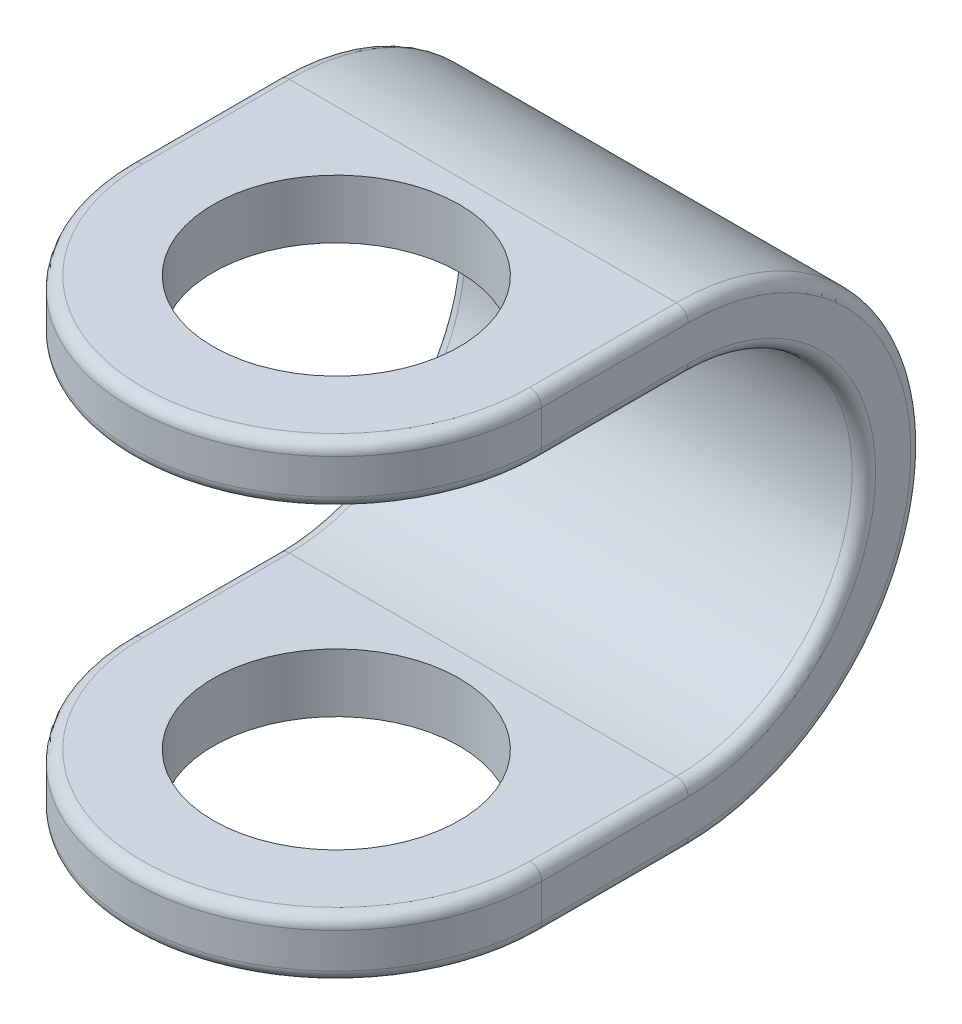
SolidWorks part; units mm, degrees
ref_plane "Front" through (0, 0, 0) normal (0, 0, 1) x (1, 0, 0)
ref_plane "Top" through (0, 0, 0) normal (0, 1, 0) x (1, 0, 0)
ref_plane "Right" through (0, 0, 0) normal (1, 0, 0) x (0, 0, -1)
sketch "Sketch1" plane through (0, 0, 0) normal (0, 1, 0) x (1, 0, 0)
  line L0 (-35, 0) -> (-35, 65)
  line L1 (-35, 65) -> (35, 65)
  line L2 (35, 65) -> (35, 0)
  arc A0 (35, 0) -> (-35, 0) centre (0, 0) cw
  dimension "D1" = 35
  dimension "D2" = 65
extrude "Base-Extrude" add sketch "Sketch1" along normal blind 80
sketch "Sketch2" plane through (35, 0, 0) normal (1, 0, 0) x (0, 0, -1)
  line L5 (0, 80) -> (65, 80) construction
  line L6 (0, 0) -> (65, 0) construction
  line L7 (65, 80) -> (65, 0) construction
  arc A0 (25, 80) -> (25, 0) centre (25, 40) cw
extrude "Cut-Extrude1" cut sketch "Sketch2" against normal through all and the other way through all
shell "Shell1" thickness 10
sketch "Sketch3" plane through (0, 80, 0) normal (0, 1, 0) x (-1, 0, 0)
  circle A0 centre (0, 0) radius 21
  dimension "D1" = 42
extrude "Cut-Extrude2" cut sketch "Sketch3" against normal through all
fillet "Fillet1" radius 2 16 edges at (-35, 0, -12.5) (-35, 80, -12.5) (35, 40, -65) (-35, 40, -65) (35, 40, -55) (-35, 40, -55) (35, 10, -12.5) (-35, 10, -12.5) (0, 10, 35) (35, 70, -12.5) (-35, 70, -12.5) (0, 70, 35) (0, 80, 35) (35, 0, -12.5) (0, 0, 35) (35, 80, -12.5)
